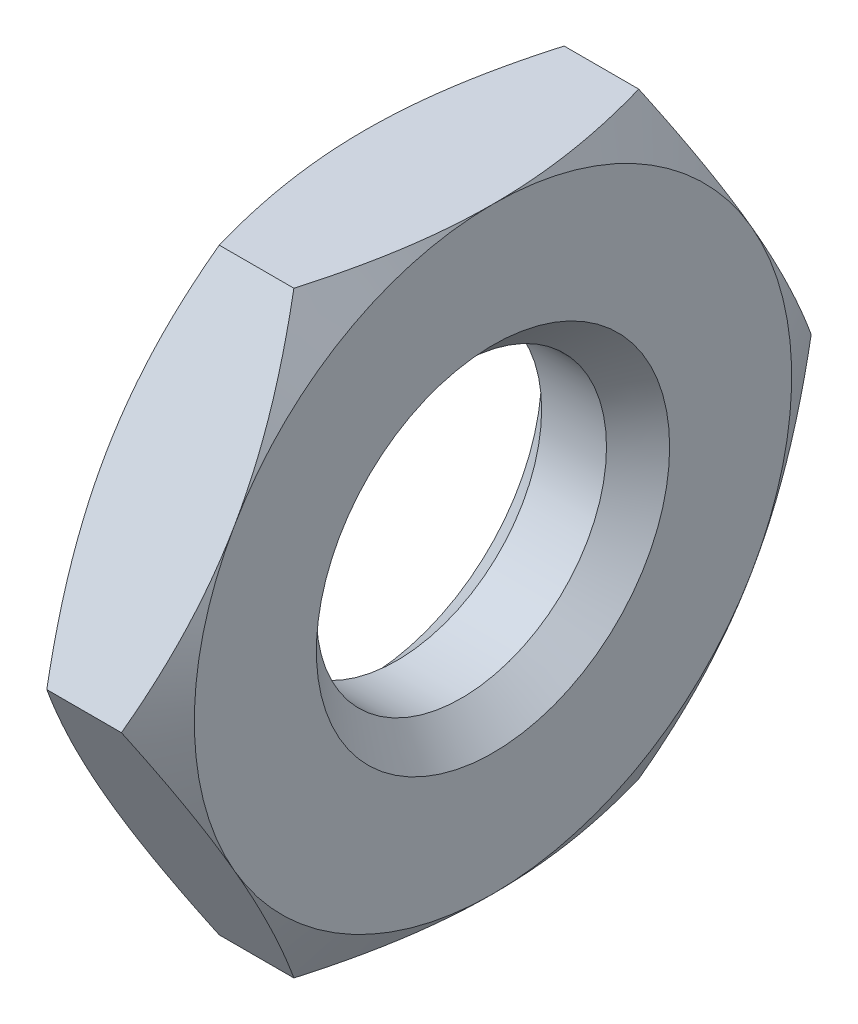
SolidWorks part; units mm, degrees
ref_plane "Front Plane" through (0, 0, 0) normal (0, 0, 1) x (1, 0, 0)
ref_plane "Top Plane" through (0, 0, 0) normal (0, 1, 0) x (1, 0, 0)
ref_plane "Right Plane" through (0, 0, 0) normal (1, 0, 0) x (0, 0, -1)
sketch "Sketch1" plane through (0, 0, 0) normal (1, 0, 0) x (0, 0, -1)
  line L1 (1.0104, 1.75) -> (-1.0104, 1.75)
  line L2 (-1.0104, 1.75) -> (-2.0207, 0)
  line L3 (-2.0207, 0) -> (-1.0104, -1.75)
  line L4 (-1.0104, -1.75) -> (1.0104, -1.75)
  line L5 (1.0104, -1.75) -> (2.0207, 0)
  line L6 (2.0207, 0) -> (1.0104, 1.75)
  circle A0 centre (0, 0) radius 1.75 construction
  circle A1 centre (0, 0) radius 0.85
extrude "Extrude1" add sketch "Sketch1" along normal blind 0.75
sketch "Sketch2" plane through (0, 0, 0) normal (0, 0, 1) x (1, 0, 0)
  line L0 (0.75, 1.75) -> (0.75, 7)
  line L1 (0.75, 7) -> (0, 7)
  line L2 (0, 7) -> (0, 1.75)
  line L3 (0, 1.75) -> (0.375, 2.3995)
  line L4 (0.375, 2.3995) -> (0.75, 1.75)
revolve "Cut-Revolve1" cut sketch "Sketch2" angle 360 about axis through (0.75, 0, 0) along (-1, 0, 0)
chamfer "Chamfer1" distance 0.185 angle 45 2 edges at (0, 0, -0.85) (0.75, 0, -0.85)
equation "\"D2@Sketch2\"=\"D1@Sketch1\"*2"
